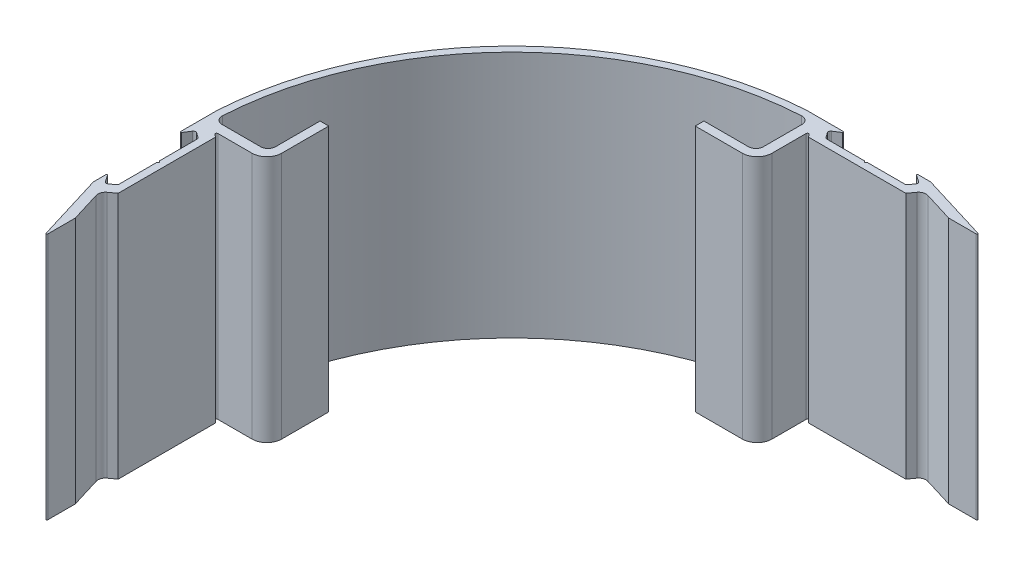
SolidWorks part; units mm, degrees
ref_plane "Front Plane" through (0, 0, 0) normal (0, 0, 1) x (1, 0, 0)
ref_plane "Top Plane" through (0, 0, 0) normal (0, 1, 0) x (1, 0, 0)
ref_plane "Right Plane" through (0, 0, 0) normal (1, 0, 0) x (0, 0, -1)
sketch "Sketch1" plane through (0, 0, 0) normal (0, 1, 0) x (1, 0, 0)
  line L0 (-121.0275, 3.9704) -> (-105.48, 3.9704)
  line L1 (-102.48, 6.9704) -> (-102.48, 24.9704)
  line L2 (-102.48, 24.9704) -> (-98.98, 24.9704)
  line L3 (-98.98, 24.9704) -> (-98.98, 5.9704)
  line L4 (-118.7437, -0.0296) -> (-104.98, -0.0296)
  line L5 (-119.0472, -0.9636) -> (-117.98, -1.739)
  line L6 (-117.98, -1.739) -> (-117.98, -41.065)
  line L7 (-117.98, -41.065) -> (-120.5793, -42.9535)
  line L8 (-121.6849, -46.2577) -> (-117.98, -58.3757)
  line L9 (-117.98, -58.3757) -> (-117.98, -69.5)
  line L10 (-118.5669, -69.5877) -> (-126.98, -42.0697)
  line L11 (-126.98, -42.0697) -> (-126.98, -37.0496)
  line L12 (-126.4284, -36.8862) -> (-124.7027, -39.5436)
  line L13 (-123.2762, -39.808) -> (-121.3922, -38.4392)
  line L14 (-120.98, -37.6301) -> (-120.98, -22.4397)
  line L15 (-120.98, -22.4397) -> (-120.48, -21.9397)
  line L16 (-120.48, -21.9397) -> (-120.98, -21.4397)
  line L17 (-120.98, -21.4397) -> (-120.98, -6.2492)
  line L18 (-121.3922, -5.4402) -> (-123.2762, -4.0714)
  line L19 (-126.4284, -6.9931) -> (-124.7027, -4.3357)
  line L20 (-126.98, -6.8297) -> (-126.98, 7.9404)
  line L21 (-7.9404, 126.98) -> (6.8297, 126.98)
  line L22 (4.3357, 124.7027) -> (6.9931, 126.4284)
  line L23 (4.0714, 123.2762) -> (5.4402, 121.3922)
  line L24 (6.2492, 120.98) -> (21.4397, 120.98)
  line L25 (21.4397, 120.98) -> (21.9397, 120.48)
  line L26 (21.9397, 120.48) -> (22.4397, 120.98)
  line L27 (22.4397, 120.98) -> (37.6301, 120.98)
  line L28 (38.4392, 121.3922) -> (39.808, 123.2762)
  line L29 (39.5436, 124.7027) -> (36.8862, 126.4284)
  line L30 (37.0496, 126.98) -> (42.0697, 126.98)
  line L31 (42.0697, 126.98) -> (69.5877, 118.5669)
  line L32 (69.5, 117.98) -> (58.3757, 117.98)
  line L33 (58.3757, 117.98) -> (46.2577, 121.6849)
  line L34 (42.9535, 120.5793) -> (41.065, 117.98)
  line L35 (41.065, 117.98) -> (21.9397, 117.98)
  line L36 (21.9397, 117.98) -> (1.739, 117.98)
  line L37 (1.739, 117.98) -> (0.9636, 119.0472)
  line L38 (0.0296, 104.98) -> (0.0296, 118.7437)
  line L39 (-5.9704, 98.98) -> (-24.9704, 98.98)
  line L40 (-24.9704, 98.98) -> (-24.9704, 102.48)
  line L41 (-24.9704, 102.48) -> (-6.9704, 102.48)
  line L42 (-3.9704, 105.48) -> (-3.9704, 121.0275)
  arc A0 (-124.0225, 7.1429) -> (-121.0275, 3.9704) centre (-121.0275, 6.9704) ccw
  arc A1 (-105.48, 3.9704) -> (-102.48, 6.9704) centre (-105.48, 6.9704) ccw
  arc A2 (-104.98, -0.0296) -> (-98.98, 5.9704) centre (-104.98, 5.9704) ccw
  arc A3 (-118.7437, -0.0296) -> (-119.0472, -0.9636) centre (-118.7437, -0.5459) ccw
  arc A4 (-120.5793, -42.9535) -> (-121.6849, -46.2577) centre (-118.816, -45.3806) ccw
  arc A5 (-118.5669, -69.5877) -> (-117.98, -69.5) centre (-118.28, -69.5) ccw
  arc A6 (-126.4284, -36.8862) -> (-126.98, -37.0496) centre (-126.68, -37.0496) ccw
  arc A7 (-124.7027, -39.5436) -> (-123.2762, -39.808) centre (-123.864, -38.999) ccw
  arc A8 (-121.3922, -38.4392) -> (-120.98, -37.6301) centre (-121.98, -37.6301) ccw
  arc A9 (-120.98, -6.2492) -> (-121.3922, -5.4402) centre (-121.98, -6.2492) ccw
  arc A10 (-123.2762, -4.0714) -> (-124.7027, -4.3357) centre (-123.864, -4.8804) ccw
  arc A11 (-126.98, -6.8297) -> (-126.4284, -6.9931) centre (-126.68, -6.8297) ccw
  arc A12 (-7.9404, 126.98) -> (-126.98, 7.9404) centre (0, 0) ccw
  arc A13 (6.9931, 126.4284) -> (6.8297, 126.98) centre (6.8297, 126.68) ccw
  arc A14 (4.3357, 124.7027) -> (4.0714, 123.2762) centre (4.8804, 123.864) ccw
  arc A15 (5.4402, 121.3922) -> (6.2492, 120.98) centre (6.2492, 121.98) ccw
  arc A16 (37.6301, 120.98) -> (38.4392, 121.3922) centre (37.6301, 121.98) ccw
  arc A17 (39.808, 123.2762) -> (39.5436, 124.7027) centre (38.999, 123.864) ccw
  arc A18 (37.0496, 126.98) -> (36.8862, 126.4284) centre (37.0496, 126.68) ccw
  arc A19 (69.5, 117.98) -> (69.5877, 118.5669) centre (69.5, 118.28) ccw
  arc A20 (46.2577, 121.6849) -> (42.9535, 120.5793) centre (45.3806, 118.816) ccw
  arc A21 (0.9636, 119.0472) -> (0.0296, 118.7437) centre (0.5459, 118.7437) ccw
  arc A22 (-5.9704, 98.98) -> (0.0296, 104.98) centre (-5.9704, 104.98) ccw
  arc A23 (-6.9704, 102.48) -> (-3.9704, 105.48) centre (-6.9704, 105.48) ccw
  arc A24 (-3.9704, 121.0275) -> (-7.1429, 124.0225) centre (-6.9704, 121.0275) ccw
  arc A25 (-7.1429, 124.0225) -> (-124.0225, 7.1429) centre (0, 0) ccw
extrude "Extrude1" add sketch "Sketch1" along normal mid plane 100
